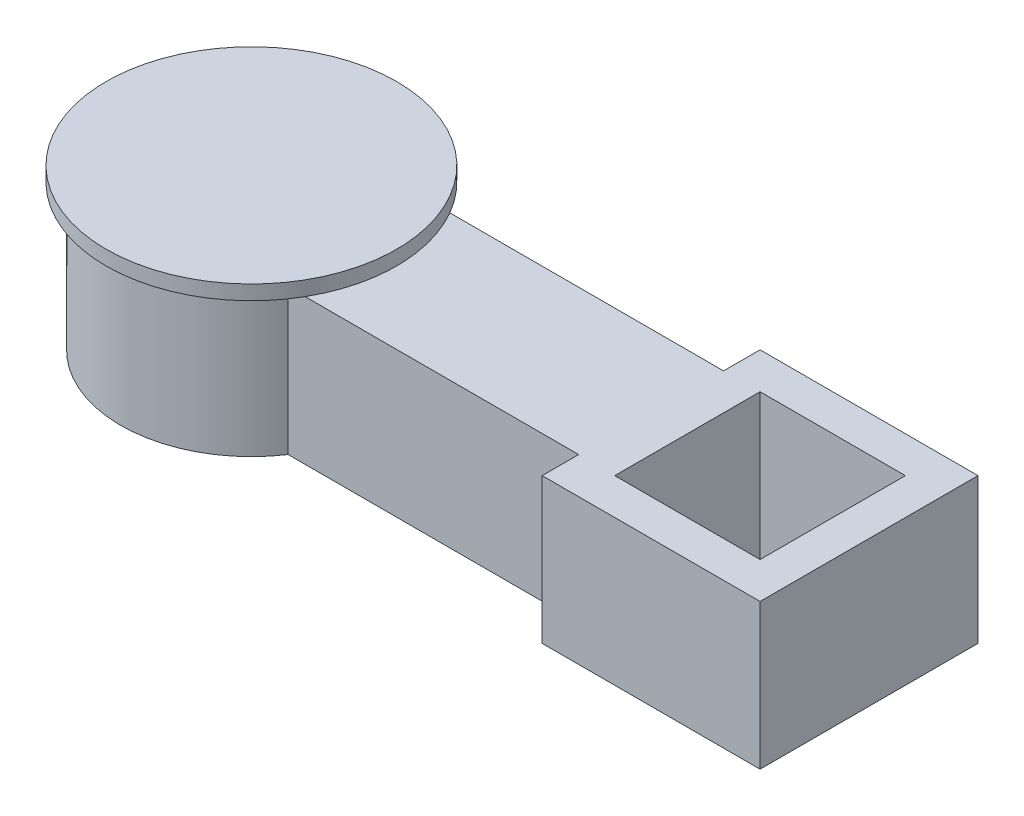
SolidWorks part; units mm, degrees
ref_plane "Front Plane" through (0, 0, 0) normal (0, 0, 1) x (1, 0, 0)
ref_plane "Top Plane" through (0, 0, 0) normal (0, 1, 0) x (1, 0, 0)
ref_plane "Right Plane" through (0, 0, 0) normal (1, 0, 0) x (0, 0, -1)
sketch "Sketch1" plane through (0, 0, 0) normal (0, 1, 0) x (1, 0, 0)
  line L0 (363.1456, 275.7418) -> (363.1456, 275.9924)
  line L1 (363.1456, 175.9924) -> (563.1456, 175.9924)
  line L2 (363.1456, 175.9924) -> (363.1456, 176.2431)
  line L3 (363.1456, 275.9924) -> (563.1456, 275.9924)
  line L4 (563.1456, 175.9924) -> (563.1456, 176.2431)
  line L5 (563.1456, 275.7418) -> (563.1456, 275.9924)
  line L8 (363.1456, 275.9924) -> (563.1456, 275.9924)
  line L9 (363.1456, 275.9924) -> (363.1456, 275.7418)
  line L10 (363.1456, 176.2431) -> (563.1456, 176.2431)
  line L11 (563.1456, 275.9924) -> (563.1456, 176.2431)
  line L12 (563.1456, 301.1178) -> (713.1456, 301.1178)
  line L13 (563.1456, 301.1178) -> (563.1456, 151.1178)
  line L14 (563.1456, 151.1178) -> (713.1456, 151.1178)
  line L15 (713.1456, 301.1178) -> (713.1456, 151.1178)
  arc A0 (363.1456, 275.7418) -> (363.1456, 176.2431) centre (288.1456, 225.9924) ccw
  point P13 (713.1456, 226.1178)
  point P14 (563.1456, 226.1178)
  dimension "D3" = 180
  dimension "D6" = 150
  dimension "D1" = 200
  dimension "D2" = 100
  dimension "D4" = 50
  dimension "D5" = 75
  dimension "D7" = 150
extrude "Boss-Extrude1" add sketch "Sketch1" along normal blind 100 contours L0 A0 L10 L11 L5 L3 | L13 L12 L15 L14
sketch "Sketch5" plane through (0, 100, 0) normal (0, 1, 0) x (1, 0, 0)
  circle A0 centre (288.1456, 225.9924) radius 70
  dimension "D1" = 140
extrude "Cut-Extrude2" cut sketch "Sketch5" against normal blind 100
sketch "Sketch6" plane through (0, 100, 0) normal (0, 1, 0) x (1, 0, 0)
  circle A0 centre (288.1456, 225.9924) radius 100
  dimension "D1" = 200
extrude "Boss-Extrude4" add sketch "Sketch6" along normal blind 10
sketch "Sketch7" plane through (0, 100, 0) normal (0, 1, 0) x (1, 0, 0)
  line L0 (563.1456, 301.1178) -> (713.1456, 301.1178) construction
  line L1 (588.1456, 176.1178) -> (688.1456, 176.1178)
  line L2 (588.1456, 176.1178) -> (588.1456, 276.1178)
  line L3 (588.1456, 276.1178) -> (688.1456, 276.1178)
  line L4 (688.1456, 176.1178) -> (688.1456, 276.1178)
  line L5 (713.1456, 301.1178) -> (713.1456, 151.1178) construction
  point P6 (638.1456, 301.1178)
  point P7 (638.1456, 276.1178)
  point P10 (713.1456, 226.1178)
  point P11 (688.1456, 226.1178)
  dimension "D1" = 100
  dimension "D2" = 100
extrude "Cut-Extrude3" cut sketch "Sketch7" against normal blind 100
